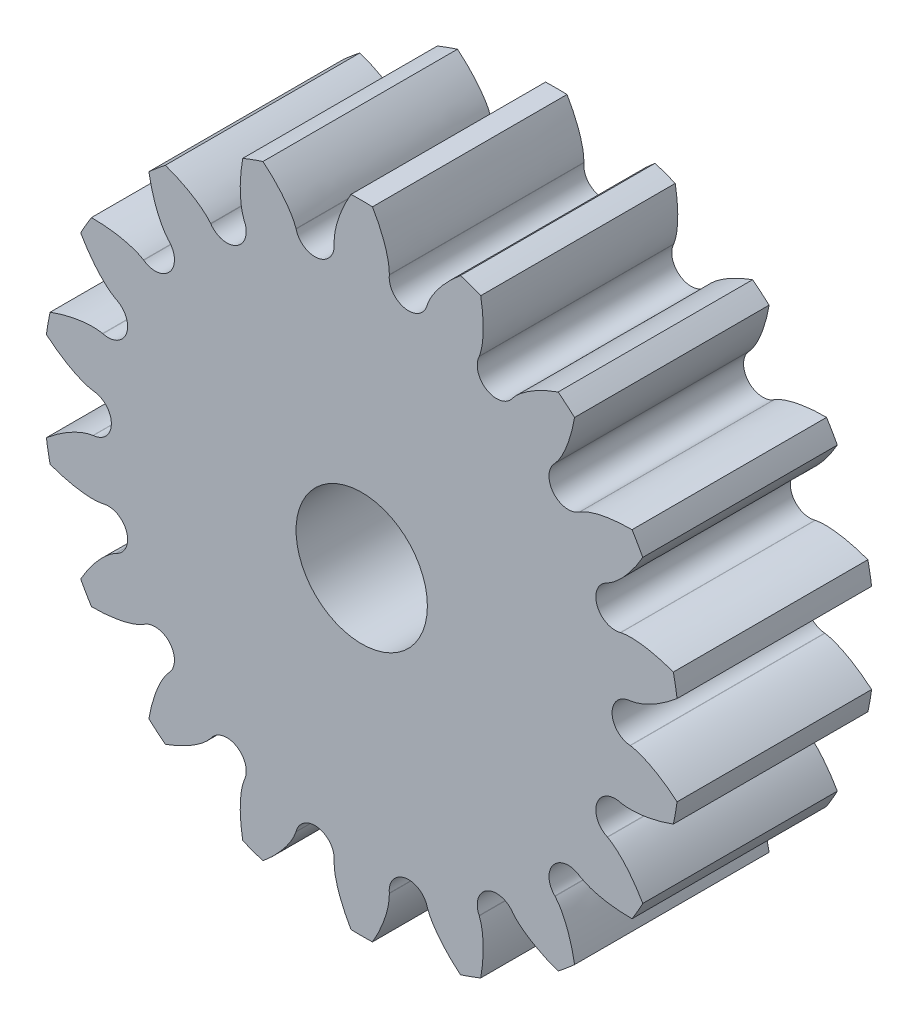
SolidWorks part; units mm, degrees
ref_plane "Front Plane" through (0, 0, 0) normal (0, 0, 1) x (1, 0, 0)
ref_plane "Top Plane" through (0, 0, 0) normal (0, 1, 0) x (1, 0, 0)
ref_plane "Right Plane" through (0, 0, 0) normal (1, 0, 0) x (0, 0, -1)
sketch "Involute construction sketch" plane through (0, 0, 0) normal (0, 0, 1) x (1, 0, 0)
  line L0 (0, 0) -> (-1.8, 3.7586) construction
  line L1 (0, 0) -> (-1.0856, 4.0235) construction
  line L2 (0, 0) -> (-0.3348, 4.1539) construction
  line L3 (0, 0) -> (0.4271, 4.1454) construction
  line L4 (-3.0265, 2.8648) -> (-2.4543, 3.368) construction
  line L5 (-2.4543, 3.368) -> (-1.8, 3.7586) construction
  line L6 (-1.8, 3.7586) -> (-1.0856, 4.0235) construction
  line L7 (0, 0) -> (-2.4543, 3.368) construction
  line L8 (0, 0) -> (-3.0265, 2.8648) construction
  line L9 (-1.0856, 4.0235) -> (-0.3348, 4.1539) construction
  line L10 (-0.3348, 4.1539) -> (0.4271, 4.1454) construction
  line L11 (-3.0265, 2.8648) -> (-0.4074, 5.6318) construction
  line L12 (-2.4543, 3.368) -> (0.009, 5.1631) construction
  line L13 (-1.8, 3.7586) -> (0.2617, 4.746) construction
  line L14 (-1.0856, 4.0235) -> (0.3858, 4.4205) construction
  line L15 (-0.3348, 4.1539) -> (0.4247, 4.2151) construction
  line L17 (0, 0) -> (0, 5.7859) construction
  line L18 (0, 0) -> (0.3865, 4.418) construction
  line L19 (0, 0) -> (0.6726, 3.8147) construction
  circle A0 centre (0, 0) radius 3.8735 construction
  circle A1 centre (0, 0) radius 4.1674 construction
  circle A2 centre (0, 0) radius 4.4348 construction
  circle A3 centre (0, 0) radius 4.9276 construction
  spline S0 degree 3 poles (0.4271, 4.1454) (0.4284, 4.2386) (0.3887, 4.4458) (0.1758, 4.9887) (-0.14, 5.3768) (-0.4074, 5.6318) knots 0 0 0 0 0.160044 0.360037 1 1 1 1 construction
  point P17 (0.1663, 4.9248)
sketch "Sketch2" plane through (0, 0, 0) normal (0, 0, 1) x (1, 0, 0)
  line L0 (0, 4.9276) -> (0, 3.8735)
  line L1 (0, 0) -> (0, 5.7859) construction
  line L2 (0.4271, 4.1454) -> (0.4266, 4.1404)
  line L3 (0, 0) -> (0.4271, 4.1454) construction
  circle A0 centre (0, 0) radius 4.9276 construction
  circle A1 centre (0, 0) radius 3.8735 construction
  arc A2 (0, 4.9276) -> (0.1663, 4.9248) centre (0, 0) cw
  arc A3 (0, 3.8735) -> (0.6726, 3.8147) centre (0, 0) cw
  arc A4 (0.4266, 4.1404) -> (0.6726, 3.8147) centre (0.7247, 4.1097) ccw
  spline S0 degree 3 poles (0.1663, 4.9248) (0.2589, 4.7664) (0.3758, 4.5128) (0.4284, 4.2386) (0.4271, 4.1454) knots 0 0 0 0 0.664052 1 1 1 1
sketch "Sketch3" plane through (0, 0, 0) normal (0, 0, 1) x (1, 0, 0)
  circle A0 centre (0, 0) radius 3.8735
  circle A1 centre (0, 0) radius 1.016
extrude "Base" add sketch "Sketch3" along normal blind 3.0099
extrude "Half tooth" add sketch "Sketch2" along normal up to surface (3.0099 mm away)
ref_plane "Midplane of half tooth" through (0, 0, 0) normal (-1, 0, 0) x (0, 0, 1)
mirror "Mirror of half tooth" about plane through (0, 0, 0) normal (-1, 0, 0) of "Half tooth"
pattern_circular "Pattern of tooth" count 18 over 360 of "Half tooth", "Mirror of half tooth"
equation "\"radtodeg\"= 180 / PI'radian to degree conversion [ ]"
equation "\"phi\"= 20'pressure angle [deg]"
equation "\"N\"= 18'number of teeth [teeth]"
equation "\"A\"= 0.388in'diameter of addendum circle [inch]"
equation "\"B\"= 0.305in'diameter of dedendum circle [inch]"
equation "\"P\"= ( \"N\" + 2 ) / \"A\"'diametral pitch [teeth/inch]"
equation "\"d\"= \"N\" / \"P\"'diameter of pitch circle [inch]"
equation "\"cp\"= PI / \"P\"'circular pitch [inch/teeth]"
equation "\"add\"= 1 / \"P\"'addendum [inch]"
equation "\"ded\"= - ( \"B\" - \"d\" ) / 2'dedendum [inch]"
equation "\"clear\"= \"ded\" - \"add\"'clearance [inch]"
equation "\"C\"= \"B\" + 2 * \"clear\"'diameter of clearance circle [inch]"
equation "\"h\"= \"add\" + \"ded\"'tooth height / whole depth [inch]"
equation "\"s\"= \"d\" * cos ( \"phi\" * 1 / \"radtodeg\" )'diameter of base circle [inch]"
equation "\"t\"= ( PI / 2 ) / \"P\"'tooth width at diameter of pitch circle diameter [inch]"
equation "\"alpha\"= ( \"t\" / ( \"d\" / 2 ) * \"radtodeg\" ) / 2'arc angle for half of tooth width at pitch circle diameter [inch]"
equation "\"bore\"= 0.0800'bore of hub [inch]"
equation "\"D4@Involute construction sketch\"= \"A\"'addendum circle"
equation "\"D3@Involute construction sketch\"= \"d\"'pitch circle"
equation "\"D2@Involute construction sketch\"= \"s\"'base circle"
equation "\"D1@Involute construction sketch\"= \"B\"'dedendum circle"
equation "\"seg\"= \"D5@Involute construction sketch\"'size of one involute segment [inch]"
equation "\"D6@Involute construction sketch\"=2*\"seg\""
equation "\"D7@Involute construction sketch\"=3*\"seg\""
equation "\"D8@Involute construction sketch\"=4*\"seg\""
equation "\"D9@Involute construction sketch\"=5*\"seg\""
equation "\"D10@Involute construction sketch\"=\"alpha\""
equation "\"D11@Involute construction sketch\"=2*\"alpha\""
equation "\"D1@Sketch3\"=\"B\""
equation "\"D1@CirPattern1\"=\"N\""
equation "\"D2@Sketch3\"=\"bore\""
